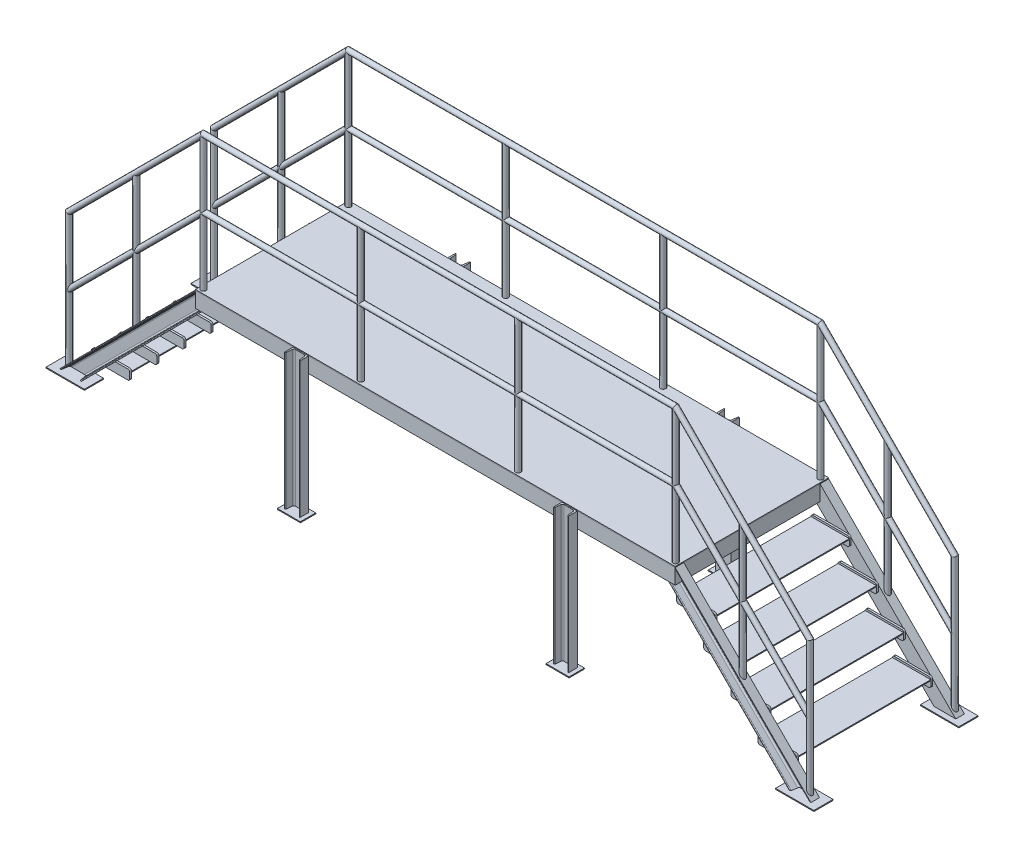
SolidWorks part; units mm, degrees
ref_plane "Front Plane" through (0, 0, 0) normal (0, 0, 1) x (1, 0, 0)
ref_plane "Top Plane" through (0, 0, 0) normal (0, 1, 0) x (1, 0, 0)
ref_plane "Right Plane" through (0, 0, 0) normal (1, 0, 0) x (0, 0, -1)
sketch "Sketch1" plane through (0, 0, 0) normal (0, 1, 0) x (1, 0, 0)
  line L0 (-450, 400) -> (-450, -400)
  line L1 (1250, 400) -> (-1250, 400)
  line L2 (1250, 400) -> (1250, -400)
  line L3 (1250, -400) -> (-1250, -400)
  line L4 (-1250, 400) -> (-1250, -400)
  line L5 (1250, 400) -> (-1250, -400) construction
  line L6 (1250, -400) -> (-1250, 400) construction
  line L7 (450, 400) -> (450, -400)
  point P0 (0, 0)
  dimension "D1" = 800
  dimension "D2" = 2500
  dimension "D3" = 800
  dimension "D4" = 800
other "C channel - configured 80 X 8(1)"
ref_plane "Plane1" through (1250, 0, 400) normal (-1, 0, 0) x (0, 0, 1)
sketch "Sketch11" plane through (1250, 0, 400) normal (-1, 0, 0) x (0, 0, 1)
  line L0 (45, 80) -> (0, 80)
  line L1 (45, 0) -> (0, 0)
  line L2 (0, 80) -> (0, 0)
  line L6 (45, 80) -> (45, 78.1774)
  line L7 (45, 0) -> (45, 1.8226)
  line L12 (5.5, 63.221) -> (5.5, 16.779)
  line L17 (12.6638, 71.1771) -> (41.4181, 74.1993)
  line L18 (12.6638, 8.8229) -> (41.4181, 5.8007)
  arc A0 (41.4181, 74.1993) -> (45, 78.1774) centre (41, 78.1774) ccw
  arc A1 (41.4181, 5.8007) -> (45, 1.8226) centre (41, 1.8226) cw
  arc A9 (5.5, 16.779) -> (12.6638, 8.8229) centre (13.5, 16.779) ccw
  arc A10 (5.5, 63.221) -> (12.6638, 71.1771) centre (13.5, 63.221) cw
  point P8 (0, 40)
  point P9 (5.5, 40)
  point P10 (22.5, 80)
  point P11 (22.5, 0)
  point P12 (45, 5.4242)
  point P13 (45, 74.5758)
  point P14 (0, 0)
  dimension "D4" = 4
  dimension "RI" = 8
  dimension "D2" = 6
  dimension "D3" = 16.779
  dimension "Depth" = 80
  dimension "BF" = 45
  dimension "TW" = 5.5
  dimension "d1" = 46.4419
sketch "Sketch12" plane through (0, 0, 400) normal (0, 0, 1) x (1, 0, 0)
  line L0 (-1250, 80) -> (-1957.1068, -627.1068)
  line L1 (-700, 80) -> (-700, -627.1068)
  line L2 (-1250, 80) -> (1250, 80) construction
  line L3 (-1957.1068, -627.1068) -> (-1744.64, -627.1068) construction
  point P7 (0, 0)
  dimension "D1" = 45
  dimension "D2" = 1000
  dimension "D3" = 700
other "C channel - configured 80 X 8(2)"
ref_plane "Plane2" through (-700, 80, 400) normal (0, -1, 0) x (0, 0, 1)
sketch "Sketch13" plane through (-700, 80, 400) normal (0, -1, 0) x (0, 0, 1)
  line L0 (45, 80) -> (0, 80)
  line L1 (45, 0) -> (0, 0)
  line L2 (0, 80) -> (0, 0)
  line L6 (45, 80) -> (45, 78.1774)
  line L7 (45, 0) -> (45, 1.8226)
  line L12 (5.5, 63.221) -> (5.5, 16.779)
  line L17 (12.6638, 71.1771) -> (41.4181, 74.1993)
  line L18 (12.6638, 8.8229) -> (41.4181, 5.8007)
  arc A0 (41.4181, 74.1993) -> (45, 78.1774) centre (41, 78.1774) ccw
  arc A1 (41.4181, 5.8007) -> (45, 1.8226) centre (41, 1.8226) cw
  arc A9 (5.5, 16.779) -> (12.6638, 8.8229) centre (13.5, 16.779) ccw
  arc A10 (5.5, 63.221) -> (12.6638, 71.1771) centre (13.5, 63.221) cw
  point P8 (0, 40)
  point P9 (5.5, 40)
  point P10 (22.5, 80)
  point P11 (22.5, 0)
  point P12 (45, 5.4242)
  point P13 (45, 74.5758)
  point P14 (0, 0)
  dimension "D4" = 4
  dimension "RI" = 8
  dimension "D2" = 6
  dimension "D3" = 16.779
  dimension "Depth" = 80
  dimension "BF" = 45
  dimension "TW" = 5.5
  dimension "d1" = 46.4419
other "Trim/Extend1"
mirror "Mirror1" about plane through (0, 0, 0) normal (0, 0, 1)
mirror "Mirror2" about plane through (0, 0, 0) normal (1, 0, 0)
sketch "Sketch14" plane through (0, 0, -355) normal (0, 0, 1) x (1, 0, 0)
  line L0 (1900.5382, -683.6753) -> (1216.8629, 0) construction
  line L1 (1646.8629, -545) -> (1826.8629, -545)
  line L2 (1636.8629, -535) -> (1636.8629, -505)
  line L3 (1646.8629, -495) -> (1826.8629, -495)
  line L4 (1836.8629, -535) -> (1836.8629, -505)
  line L5 (1636.8629, -545) -> (1836.8629, -495) construction
  line L6 (1636.8629, -495) -> (1836.8629, -545) construction
  line L7 (-1250, 80) -> (1250, 80) construction
  arc A0 (1826.8629, -545) -> (1836.8629, -535) centre (1826.8629, -535) ccw
  arc A1 (1636.8629, -505) -> (1646.8629, -495) centre (1646.8629, -505) cw
  arc A2 (1646.8629, -545) -> (1636.8629, -535) centre (1646.8629, -535) cw
  arc A3 (1826.8629, -495) -> (1836.8629, -505) centre (1826.8629, -505) cw
  point P0 (1736.8629, -520)
  dimension "D3" = 10
  dimension "D1" = 200
  dimension "D2" = 50
  dimension "D4" = 600
extrude "Boss-Extrude1" add sketch "Sketch14" along normal blind 10 separate body
pattern_linear "LPattern1" count 4 spacing 200 along (-0.7071, 0.7071, 0)
mirror "Mirror3" about plane through (0, 0, 0) normal (0, 0, 1)
mirror "Mirror4" about plane through (0, 0, 0) normal (1, 0, 0)
sketch "Sketch15" plane through (0, 0, -345) normal (0, 0, 1) x (1, 0, 0)
  line L0 (1636.8629, -505) -> (1836.8629, -505)
  line L1 (1495.4416, -363.5786) -> (1695.4416, -363.5786)
  line L2 (1354.0202, -222.1573) -> (1554.0202, -222.1573)
  line L3 (1212.5988, -80.7359) -> (1412.5988, -80.7359)
extrude "Extrude-Thin1" add sketch "Sketch15" along normal up to surface (690 mm away) separate body thin
mirror "Mirror5" about plane through (0, 0, 0) normal (1, 0, 0)
sketch "Sketch16" plane through (0, 80, 0) normal (0, 1, 0) x (1, 0, 0)
  line L1 (-1250, 400) -> (1250, 400)
  line L2 (-1250, 400) -> (-1250, -400)
  line L3 (-1250, -400) -> (1250, -400)
  line L4 (1250, 400) -> (1250, -400)
extrude "Boss-Extrude2" add sketch "Sketch16" along normal blind 5 separate body
ref_plane "Plane3" through (1957.1068, -627.1068, 377.5) normal (0, 0, -1) x (-1, 0, 0)
sketch "Sketch17" plane through (1957.1068, -627.1068, 377.5) normal (0, 0, -1) x (-1, 0, 0)
  line L0 (1957.1068, 712.1068) -> (1957.1068, 1412.1068) construction
  line L1 (707.1068, 712.1068) -> (3207.1068, 712.1068) construction
  line L2 (3187.1068, 1412.1068) -> (727.1068, 1412.1068)
  line L3 (727.1068, 1412.1068) -> (727.1068, 712.1068)
  line L4 (1547.1068, 1412.1068) -> (1547.1068, 712.1068)
  line L5 (727.1068, 1412.1068) -> (27.1068, 712.1068)
  line L6 (27.1068, 712.1068) -> (27.1068, 12.1068)
  line L7 (1.2888, -1.2888) -> (707.1068, 704.5293) construction
  line L8 (27.1068, 362.1068) -> (727.1068, 1062.1068)
  line L9 (727.1068, 1062.1068) -> (3187.1068, 1062.1068)
  line L10 (3887.1068, 362.1068) -> (3187.1068, 1062.1068)
  line L11 (3887.1068, 712.1068) -> (3887.1068, 12.1068)
  line L12 (3187.1068, 1412.1068) -> (3887.1068, 712.1068)
  line L13 (2367.1068, 1412.1068) -> (2367.1068, 712.1068)
  line L14 (3187.1068, 1412.1068) -> (3187.1068, 712.1068)
  line L15 (377.1068, 1062.1068) -> (377.1068, 362.1068)
  line L16 (3537.1068, 1062.1068) -> (3537.1068, 362.1068)
  point P17 (1957.1068, 1062.1068)
  dimension "D1" = 700
  dimension "D2" = 410
  dimension "D3" = 820
  dimension "D4" = 700
other "Pipe - configured 26.9 X 3.2(1)"
ref_plane "Plane4" through (-1930, 85, 377.5) normal (0, -1, 0) x (-1, 0, 0)
sketch "Sketch18" plane through (-1930, 85, 377.5) normal (0, -1, 0) x (-1, 0, 0)
  circle A0 centre (0, 0) radius 10.25
  circle A1 centre (0, 0) radius 13.45
  point P3 (0, 13.45)
  point P5 (-13.45, 0)
  point P6 (0, -13.45)
  point P7 (13.45, 0)
  point P8 (0, 0)
  dimension "In_dia" = 20.5
  dimension "Out_dia" = 26.9
other "Trim/Extend2"
other "Trim/Extend3"
mirror "Mirror6" about plane through (0, 0, 0) normal (0, 0, 1)
sketch "Sketch19" plane through (0, 0, 0) normal (0, 0, 1) x (1, 0, 0)
  line L1 (-1957.1068, -627.1068) -> (2215.212, -627.1068)
  line L2 (-1957.1068, -627.1068) -> (-1957.1068, -1154.6301)
  line L3 (-1957.1068, -1154.6301) -> (2215.212, -1154.6301)
  line L4 (2215.212, -627.1068) -> (2215.212, -1154.6301)
extrude "Cut-Extrude1" cut sketch "Sketch19" against normal through all both and the other way through all
sketch "Sketch20" plane through (0, -627.1068, 0) normal (0, -1, 0) x (1, 0, 0)
  line L0 (-1900.5382, 355) -> (-1900.5382, 377.5) construction
  line L1 (-2000.5382, 427.5) -> (-1800.5382, 427.5)
  line L2 (-2000.5382, 427.5) -> (-2000.5382, 327.5)
  line L3 (-2000.5382, 327.5) -> (-1800.5382, 327.5)
  line L4 (-1800.5382, 427.5) -> (-1800.5382, 327.5)
  line L5 (-2000.5382, 427.5) -> (-1800.5382, 327.5) construction
  line L6 (-2000.5382, 327.5) -> (-1800.5382, 427.5) construction
  line L7 (-1843.9697, 355) -> (-1957.1068, 355) construction
  line L8 (-1900.5382, 377.5) -> (-1843.9697, 377.5) construction
  line L9 (-1843.9697, 400) -> (-1843.9697, 355) construction
  line L10 (-700, 400) -> (-700, 422.5) construction
  line L11 (-760, 462.5) -> (-640, 462.5)
  line L12 (-760, 462.5) -> (-760, 382.5)
  line L13 (-760, 382.5) -> (-640, 382.5)
  line L14 (-640, 462.5) -> (-640, 382.5)
  line L15 (-760, 462.5) -> (-640, 382.5) construction
  line L16 (-760, 382.5) -> (-640, 462.5) construction
  line L17 (-740, 400) -> (-660, 400) construction
  line L18 (-700, 422.5) -> (-660, 422.5) construction
  line L19 (-660, 400) -> (-660, 445) construction
  point P0 (-1900.5382, 377.5)
  point P9 (-700, 422.5)
  dimension "D1" = 200
  dimension "D2" = 100
  dimension "D3" = 120
  dimension "D4" = 80
extrude "Boss-Extrude3" add sketch "Sketch20" along normal blind 5 separate body
mirror "Mirror7" about plane through (0, 0, 0) normal (0, 0, 1)
mirror "Mirror8" about plane through (0, 0, 0) normal (1, 0, 0)
